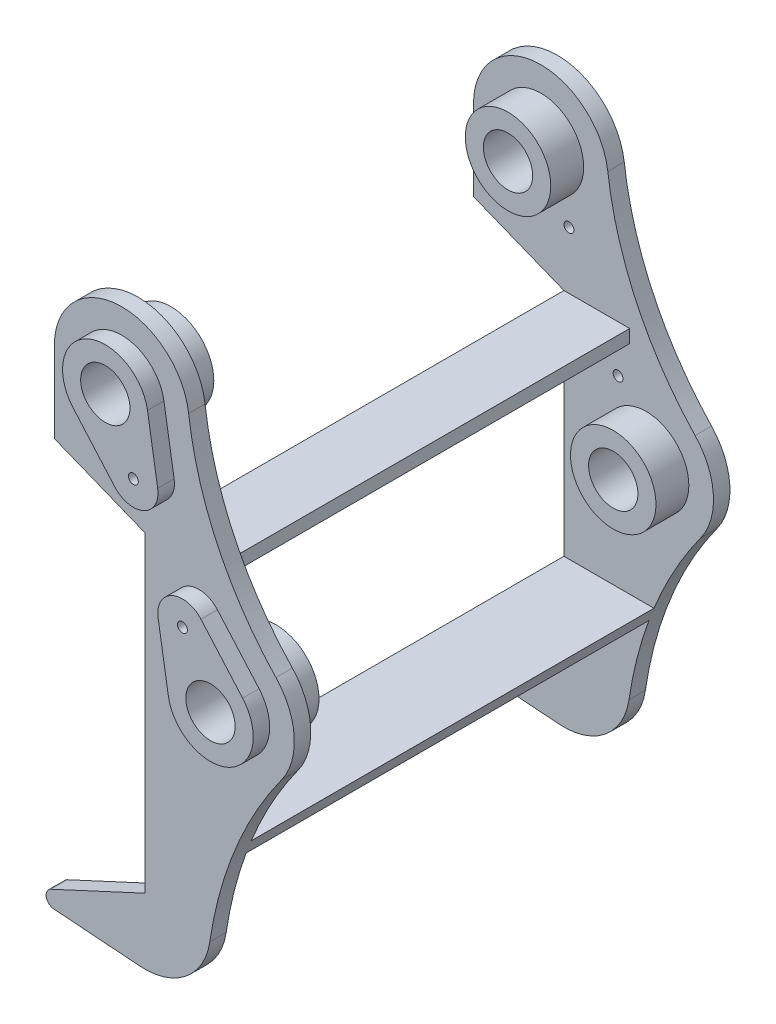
SolidWorks part; units mm, degrees
ref_plane "前视基准面" through (0, 0, 0) normal (0, 0, 1) x (1, 0, 0)
ref_plane "上视基准面" through (0, 0, 0) normal (0, 1, 0) x (1, 0, 0)
ref_plane "右视基准面" through (0, 0, 0) normal (1, 0, 0) x (0, 0, -1)
sketch "草图1" plane through (0, 0, 0) normal (0, 0, 1) x (1, 0, 0)
  line L0 (14, -71) -> (14, -261)
  line L1 (14, -261) -> (-43.1024, -287.4635)
  line L2 (-41, 0) -> (-41, -49)
  line L3 (-41, -49) -> (14, -71)
  line L4 (11.0286, -300.8895) -> (-41.3714, -296.9862)
  arc A0 (40.6834, 5.085) -> (-41, 0) centre (0, 0) ccw
  arc A1 (-43.1024, -287.4635) -> (-41.3714, -296.9862) centre (-41, -292) ccw
  circle A2 centre (64, -135.6613) radius 15.6883 construction
  arc A3 (97.1998, -159.719) -> (93.7955, -107.497) centre (64, -135.6613) ccw
  arc A4 (40.6834, 5.085) -> (93.7955, -107.497) centre (239.1393, 29.89) ccw
  arc A5 (11.0286, -300.8895) -> (53.5717, -266.8381) centre (14, -261) ccw
  arc A6 (97.1998, -159.719) -> (53.5717, -266.8381) centre (293.9695, -302.3048) ccw
  dimension "D1" = 82
  dimension "D2" = 55
  dimension "D3" = 49
  dimension "D6" = 10
  dimension "D7" = 50
  dimension "D8" = 150
  dimension "D9" = 82
  dimension "D10" = 200
  dimension "D11" = 80
  dimension "D12" = 243
  dimension "D14" = 60
  dimension "D4" = 22
  dimension "D5" = 190
  dimension "D13" = 243
extrude "拉伸1" add sketch "草图1" along normal blind 10 from offset 122.5
sketch "草图5" plane through (0, 0, 0) normal (0, 0, 1) x (1, 0, 0)
  line L5 (14, -261) -> (-43.1024, -287.4635)
  line L6 (14, -71) -> (14, -261)
  line L7 (-41, -49) -> (14, -71)
  line L8 (-41, 0) -> (-41, -49)
  line L9 (-41.3714, -296.9862) -> (11.0286, -300.8895)
  line L10 (14, -261) -> (-43.1024, -287.4635)
  line L11 (14, -71) -> (14, -261)
  line L12 (-41, -49) -> (14, -71)
  line L13 (-41, 0) -> (-41, -49)
  line L14 (-41.3714, -296.9862) -> (11.0286, -300.8895)
  arc A6 (40.6834, 5.085) -> (-41, 0) centre (0, 0) ccw
  arc A7 (40.6834, 5.085) -> (93.7955, -107.497) centre (239.1393, 29.89) ccw
  arc A8 (97.1998, -159.719) -> (93.7955, -107.497) centre (64, -135.6613) ccw
  arc A9 (97.1998, -159.719) -> (53.5717, -266.8381) centre (293.9695, -302.3048) ccw
  arc A10 (11.0286, -300.8895) -> (53.5717, -266.8381) centre (14, -261) ccw
  arc A11 (-43.1024, -287.4635) -> (-41.3714, -296.9862) centre (-41, -292) ccw
  arc A12 (40.6834, 5.085) -> (-41, 0) centre (0, 0) ccw
  arc A13 (40.6834, 5.085) -> (93.7955, -107.497) centre (239.1393, 29.89) ccw
  arc A14 (97.1998, -159.719) -> (93.7955, -107.497) centre (64, -135.6613) ccw
  arc A15 (97.1998, -159.719) -> (53.5717, -266.8381) centre (293.9695, -302.3048) ccw
  arc A16 (11.0286, -300.8895) -> (53.5717, -266.8381) centre (14, -261) ccw
  arc A17 (-43.1024, -287.4635) -> (-41.3714, -296.9862) centre (-41, -292) ccw
  dimension "D1" = 0
extrude "拉伸4" add sketch "草图5" against normal blind 10 from offset 122.5
sketch "草图2" plane through (0, 0, 132.5) normal (0, 0, 1) x (1, 0, 0)
  line L0 (0, 0) -> (64, -135.6613) construction
  line L1 (-19.5573, -17.1321) -> (5.7836, -46.0603)
  line L2 (25.6587, 4.1991) -> (31.8697, -33.7538)
  line L3 (32.1303, -101.9075) -> (38.3413, -139.8604)
  line L4 (58.2164, -89.6011) -> (83.5573, -118.5292)
  arc A1 (5.7836, -46.0603) -> (31.8697, -33.7538) centre (17.0667, -36.1764) ccw
  arc A2 (38.3413, -139.8604) -> (83.5573, -118.5292) centre (64, -135.6613) ccw
  arc A3 (58.2164, -89.6011) -> (32.1303, -101.9075) centre (46.9333, -99.485) ccw
  arc A4 (25.6587, 4.1991) -> (-19.5573, -17.1321) centre (0, 0) ccw
  dimension "D1" = 26
  dimension "D2" = 52
  dimension "D3" = 30
  dimension "D4" = 30
  dimension "D5" = 40
  dimension "D6" = 40
extrude "拉伸2" add sketch "草图2" along normal blind 10
sketch "草图3" plane through (0, 0, 122.5) normal (0, 0, -1) x (-1, 0, 0)
  circle A0 centre (0, 0) radius 26
  circle A1 centre (-64, -135.6613) radius 26
  dimension "D1" = 52
  dimension "D2" = 52
extrude "拉伸3" add sketch "草图3" along normal blind 20
sketch "草图4" plane through (0, 0, 142.5) normal (0, 0, 1) x (1, 0, 0)
  circle A0 centre (0, 0) radius 15
  circle A1 centre (64, -135.6613) radius 15
  circle A2 centre (46.9333, -99.485) radius 3
  circle A3 centre (17.0667, -36.1764) radius 3
  dimension "D1" = 30
  dimension "D2" = 6
  dimension "D3" = 30
  dimension "D4" = 6
extrude "切除-拉伸1" cut sketch "草图4" against normal through all
sketch "草图6" plane through (0, 0, -132.5) normal (0, 0, -1) x (-1, 0, 0)
  line L0 (0, 0) -> (-64, -135.6613) construction
  line L1 (-25.6587, 4.1991) -> (-31.8697, -33.7538)
  line L2 (19.5573, -17.1321) -> (-5.7836, -46.0603)
  line L3 (-83.5573, -118.5292) -> (-58.2164, -89.6011)
  line L4 (-38.3413, -139.8604) -> (-32.1303, -101.9075)
  arc A0 (19.5573, -17.1321) -> (-25.6587, 4.1991) centre (0, 0) ccw
  arc A2 (-83.5573, -118.5292) -> (-38.3413, -139.8604) centre (-64, -135.6613) ccw
  arc A4 (-32.1303, -101.9075) -> (-58.2164, -89.6011) centre (-46.9333, -99.485) ccw
  arc A5 (-31.8697, -33.7538) -> (-5.7836, -46.0603) centre (-17.0667, -36.1764) ccw
  dimension "D1" = 52
  dimension "D2" = 15
  dimension "D3" = 40
  dimension "D4" = 26
  dimension "D5" = 15
  dimension "D6" = 40
extrude "拉伸5" add sketch "草图6" along normal blind 10
sketch "草图7" plane through (0, 0, -122.5) normal (0, 0, 1) x (1, 0, 0)
  circle A0 centre (0, 0) radius 26
  circle A1 centre (64, -135.6613) radius 26
  dimension "D1" = 52
  dimension "D2" = 52
extrude "拉伸6" add sketch "草图7" along normal blind 20
sketch "草图8" plane through (0, 0, -102.5) normal (0, 0, 1) x (1, 0, 0)
  circle A0 centre (0, 0) radius 15
  circle A1 centre (17.0667, -36.1764) radius 3
  circle A2 centre (46.9333, -99.485) radius 3
  circle A3 centre (64, -135.6613) radius 15
extrude "切除-拉伸2" cut sketch "草图8" against normal through all
sketch "草图9" plane through (0, 0, 132.5) normal (0, 0, 1) x (1, 0, 0)
  line L0 (14, -211) -> (68.7753, -211)
  line L1 (14, -71) -> (14, -261) construction
  line L2 (14, -219) -> (65.6948, -219)
  line L3 (14, -71) -> (54, -71)
  line L4 (54, -71) -> (54, -79)
  line L5 (54, -79) -> (14, -79)
  line L6 (14, -79) -> (14, -71)
  line L7 (14, -211) -> (14, -219)
  arc A0 (97.1998, -159.719) -> (53.5717, -266.8381) centre (293.9695, -302.3048) ccw construction
  arc A1 (68.7753, -211) -> (65.6948, -219) centre (293.9695, -302.3048) ccw
  dimension "D1" = 40
  dimension "D2" = 8
  dimension "D3" = 140
  dimension "D4" = 8
extrude "拉伸7" add sketch "草图9" against normal up to surface (255 mm away)
